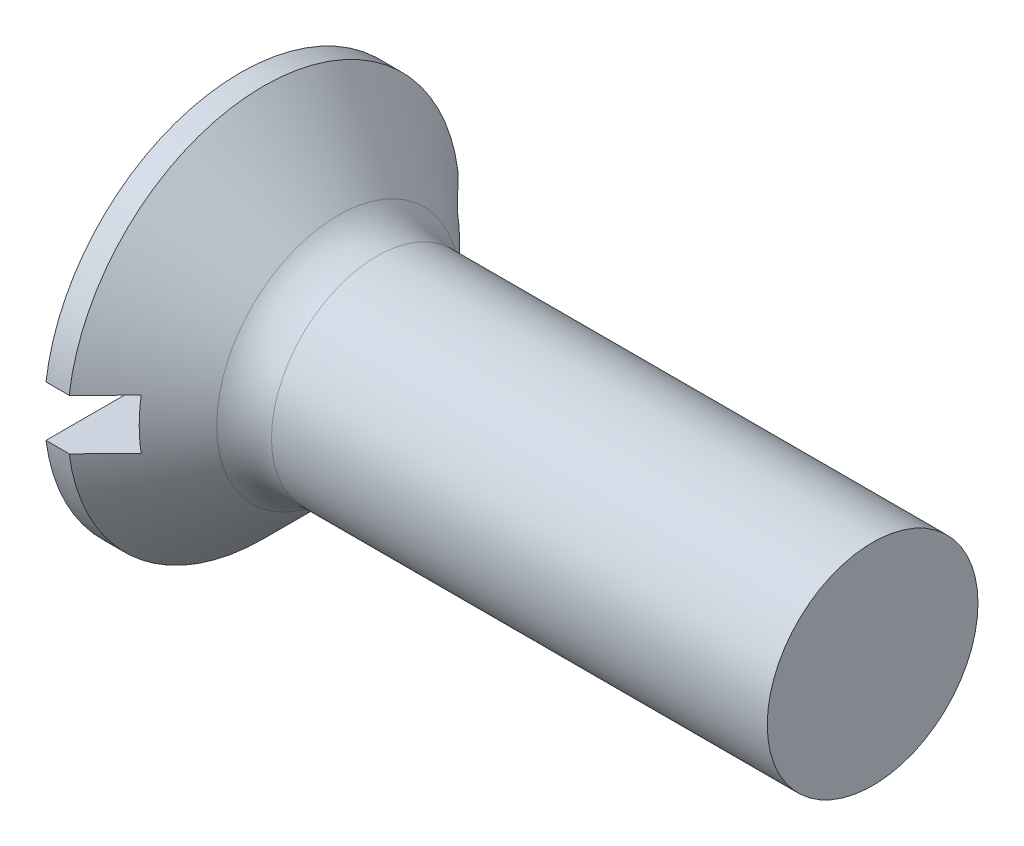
SolidWorks part; units mm, degrees
ref_plane "Plane1" through (0, 0, 0) normal (0, 0, 1) x (1, 0, 0)
ref_plane "Plane2" through (0, 0, 0) normal (0, 1, 0) x (1, 0, 0)
ref_plane "Plane3" through (0, 0, 0) normal (1, 0, 0) x (0, 0, -1)
sketch "BodySke" plane through (0, 0, 0) normal (0, 0, 1) x (1, 0, 0)
  line L0 (0, 0) -> (0, 4.65)
  line L1 (0, 4.65) -> (0.55, 4.65)
  line L2 (2.7, 2.5) -> (15, 2.5)
  line L3 (15, 2.5) -> (15, 0)
  line L4 (15, 0) -> (0, 0)
  line L5 (-6.35, 0) -> (82.55, 0) construction
  line L6 (2.7, -2.5) -> (15, -2.5) construction
  line L7 (0.55, -4.65) -> (2.7, -2.5) construction
  line L8 (0.55, 4.65) -> (2.7, 2.5)
  line L9 (0, -4.65) -> (0.55, -4.65) construction
  line L10 (3.5, 4.0875) -> (3.5, -5.4375) construction
  line L11 (-1, 6.35) -> (-1, -3.175) construction
  dimension "Diameter" = 5
  dimension "Length" = 15
  dimension "Head_ht" = 2.7
  dimension "Head_dia" = 9.3
  dimension "Head_ang" = 90
  dimension "D6" = 0.55
  dimension "Advance" = 0.8
  dimension "Thread_nom" = 16
revolve "Base-Revolve" add sketch "BodySke" angle 360 about L5
fillet "Fillet1" radius 1.3 1 edges at (2.7, 0, 2.5)
sketch "Sketch2" plane through (0, 0, 0) normal (-1, 0, 0) x (0, 0, 1)
  line L0 (-4.65, -0.6) -> (4.65, -0.6)
  line L1 (-4.65, -0.6) -> (-4.65, 0.6)
  line L2 (4.65, 0.6) -> (-4.65, 0.6)
  line L3 (4.65, 0.6) -> (4.65, -0.6)
  dimension "D1" = 0.6
  dimension "Slot_width" = 1.2
  dimension "D2" = 9.3
  dimension "D3" = 4.65
extrude "Slot" cut sketch "Sketch2" against normal blind 1.4
sketch "ThdSchSke" plane through (0, 0, 0) normal (0, 0, 1) x (1, 0, 0)
  line L0 (3.5, -2.055) -> (3.1884, -2.5)
  line L1 (3.5, -2.055) -> (3.8116, -2.5)
  line L2 (3.8116, -2.5) -> (3.8116, -3.125)
  line L3 (-3.175, 0) -> (5.1513, 0) construction
  line L5 (3.8116, -3.125) -> (3.1884, -3.125)
  line L6 (3.1884, -3.125) -> (3.1884, -2.5)
  line L7 (0, 4.65) -> (0, 0.6) construction
  dimension "Thread_minor" = 4.11
  dimension "Diameter" = 5
  dimension "Start" = 3.5
  dimension "SideAngle" = 55
  dimension "VeeAngle" = 70
  dimension "Overcut" = 6.25
revolve "ThreadSchematic" [suppressed] cut sketch "ThdSchSke" angle 360 about L3
pattern_linear "ThdSchPat" [suppressed]
equation "\"D1@Sketch2\" = \"Slot_width@Sketch2\" / 2"
equation "\"D2@Sketch2\" = \"Head_dia@BodySke\""
equation "\"D3@Sketch2\" = \"D2@Sketch2\" / 2"
equation "\"Thread_length@ThreadCosmetic\" = ((sgn( (\"Length@BodySke\" - \"Advance@BodySke\" * 1.0 - \"Head_ht@BodySke\" ) - \"Thread_nom@BodySke\" )-1)*( (\"Length@BodySke\" - \"Advance@BodySke\" * 1.0 - \"Head_ht@BodySke\" "
equation "\"Thread_minor@ThdSchSke\" = \"Thread_minor@ThreadCosmetic\""
equation "\"Diameter@ThdSchSke\" = \"Diameter@BodySke\""
equation "\"Overcut@ThdSchSke\" = \"Diameter@BodySke\" * 1.25"
equation "\"Start@ThdSchSke\" = 0.000001 + \"Length@BodySke\" - \"Thread_length@ThreadCosmetic\"  '---Countersunk---"
equation "\"Num_threads@ThdSchPat\" = int( \"Thread_length@ThreadCosmetic\" / \"Advance@BodySke\" + 0.999 )  + 1"
equation "\"Advance@ThdSchPat\" = \"Thread_length@ThreadCosmetic\" /  (\"Num_threads@ThdSchPat\" - 1) 'relax it"
